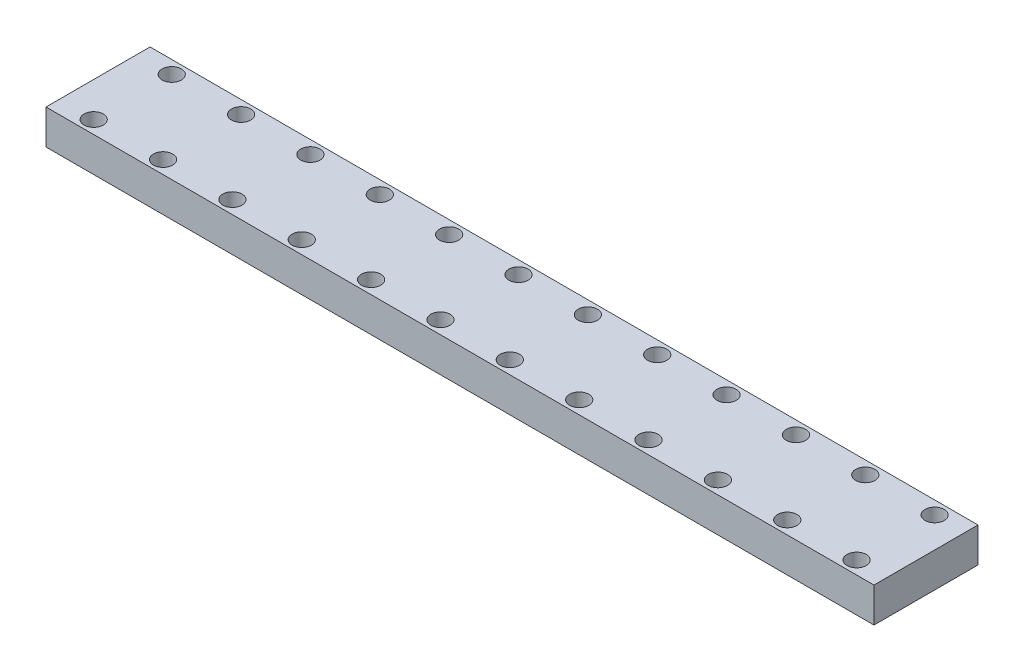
SolidWorks part; units mm, degrees
ref_plane "前视基准面" through (0, 0, 0) normal (0, 0, 1) x (1, 0, 0)
ref_plane "上视基准面" through (0, 0, 0) normal (0, 1, 0) x (1, 0, 0)
ref_plane "右视基准面" through (0, 0, 0) normal (1, 0, 0) x (0, 0, -1)
sketch "草图1" plane through (0, 0, 0) normal (0, 1, 0) x (1, 0, 0)
  line L1 (-22.7143, 10.5714) -> (168.2857, 10.5714)
  line L2 (-22.7143, 10.5714) -> (-22.7143, -13.4286)
  line L3 (-22.7143, -13.4286) -> (168.2857, -13.4286)
  line L4 (168.2857, 10.5714) -> (168.2857, -13.4286)
  circle A0 centre (-14.7143, 7.5714) radius 2.2221
  circle A1 centre (1.2857, 7.5714) radius 2.2221
  circle A2 centre (17.2857, 7.5714) radius 2.2221
  circle A3 centre (33.2857, 7.5714) radius 2.2221
  circle A4 centre (49.2857, 7.5714) radius 2.2221
  circle A5 centre (65.2857, 7.5714) radius 2.2221
  circle A6 centre (81.2857, 7.5714) radius 2.2221
  circle A7 centre (97.2857, 7.5714) radius 2.2221
  circle A8 centre (113.2857, 7.5714) radius 2.2221
  circle A9 centre (129.2857, 7.5714) radius 2.2221
  circle A10 centre (145.2857, 7.5714) radius 2.2221
  circle A11 centre (161.2857, 7.5714) radius 2.2221
  circle A12 centre (-14.7143, -10.4286) radius 2.2221
  circle A13 centre (1.2857, -10.4286) radius 2.2221
  circle A14 centre (17.2857, -10.4286) radius 2.2221
  circle A15 centre (33.2857, -10.4286) radius 2.2221
  circle A16 centre (49.2857, -10.4286) radius 2.2221
  circle A17 centre (65.2857, -10.4286) radius 2.2221
  circle A18 centre (81.2857, -10.4286) radius 2.2221
  circle A19 centre (97.2857, -10.4286) radius 2.2221
  circle A20 centre (113.2857, -10.4286) radius 2.2221
  circle A21 centre (129.2857, -10.4286) radius 2.2221
  circle A22 centre (145.2857, -10.4286) radius 2.2221
  circle A23 centre (161.2857, -10.4286) radius 2.2221
  dimension "D1" = 24
  dimension "D2" = 191
  dimension "D3" = 8
  dimension "D4" = 3
  dimension "D5" = 2
  dimension "D6" = 2
  dimension "D7" = 2
  dimension "D8" = 2
  dimension "D9" = 2
extrude "凸台-拉伸1" add sketch "草图1" along normal blind 8
